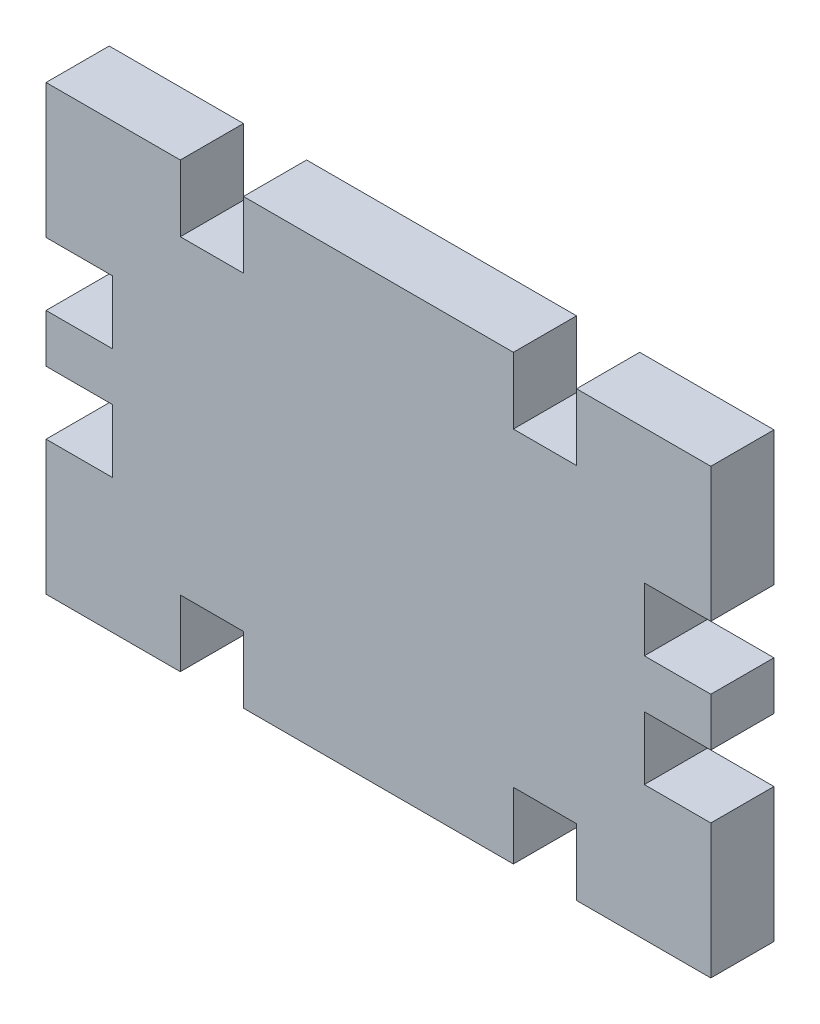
SolidWorks part; units mm, degrees
ref_plane "Piano frontale" through (0, 0, 0) normal (0, 0, 1) x (1, 0, 0)
ref_plane "Piano superiore" through (0, 0, 0) normal (0, 1, 0) x (1, 0, 0)
ref_plane "Piano destro" through (0, 0, 0) normal (1, 0, 0) x (0, 0, -1)
sketch "Sketch3" plane through (0, 0, 0) normal (0, 0, 1) x (1, 0, 0)
  line L1 (21.6975, 12.7076) -> (81.6975, 12.7076)
  line L2 (21.6975, 12.7076) -> (21.6975, -27.2924)
  line L3 (21.6975, -27.2924) -> (81.6975, -27.2924)
  line L4 (81.6975, 12.7076) -> (81.6975, -27.2924)
  dimension "D1" = 40
  dimension "D2" = 60
extrude "Boss-Extrude1" add sketch "Sketch3" along normal blind 5.7
sketch "Sketch9" plane through (0, 0, 5.7) normal (0, 0, 1) x (1, 0, 0)
  line L0 (21.6975, 12.7076) -> (21.6975, -27.2924) construction
  line L1 (33.6975, -15.2924) -> (21.6975, -27.2924) construction
  line L2 (21.6975, -9.4741) -> (27.6975, -9.4741)
  line L3 (33.8159, -27.2924) -> (39.5159, -27.2924)
  line L4 (33.8159, -27.2924) -> (33.8159, -21.2924)
  line L5 (33.8159, -21.2924) -> (39.5159, -21.2924)
  line L6 (21.6975, -27.2924) -> (81.6975, -27.2924) construction
  line L7 (39.5159, -27.2924) -> (39.5159, -21.2924)
  line L8 (21.6975, -15.1741) -> (21.6975, -9.4741)
  line L9 (21.6975, -15.1741) -> (27.6975, -15.1741)
  line L10 (27.6975, -15.1741) -> (27.6975, -9.4741)
  line L11 (39.5159, 12.7076) -> (39.5159, 6.7076)
  line L12 (21.6975, -7.2924) -> (81.6975, -7.2924) construction
  line L13 (81.6975, -27.2924) -> (81.6975, 12.7076) construction
  line L14 (51.6975, 12.7076) -> (51.6975, -27.3575) construction
  line L15 (81.6975, 12.7076) -> (21.6975, 12.7076) construction
  line L16 (33.8159, 6.7076) -> (39.5159, 6.7076)
  line L17 (33.8159, 12.7076) -> (33.8159, 6.7076)
  line L18 (33.8159, 12.7076) -> (39.5159, 12.7076)
  line L19 (27.6975, 0.5892) -> (27.6975, -5.1108)
  line L20 (21.6975, 0.5892) -> (27.6975, 0.5892)
  line L21 (21.6975, 0.5892) -> (21.6975, -5.1108)
  line L22 (21.6975, -5.1108) -> (27.6975, -5.1108)
  line L23 (81.6975, -5.1108) -> (75.6975, -5.1108)
  line L24 (81.6975, 0.5892) -> (81.6975, -5.1108)
  line L25 (81.6975, 0.5892) -> (75.6975, 0.5892)
  line L26 (75.6975, 0.5892) -> (75.6975, -5.1108)
  line L27 (69.5792, 12.7076) -> (63.8792, 12.7076)
  line L28 (69.5792, 12.7076) -> (69.5792, 6.7076)
  line L29 (69.5792, 6.7076) -> (63.8792, 6.7076)
  line L30 (63.8792, 12.7076) -> (63.8792, 6.7076)
  line L31 (63.8792, -27.2924) -> (63.8792, -21.2924)
  line L32 (69.5792, -21.2924) -> (63.8792, -21.2924)
  line L33 (69.5792, -27.2924) -> (69.5792, -21.2924)
  line L34 (69.5792, -27.2924) -> (63.8792, -27.2924)
  line L35 (75.6975, -15.1741) -> (75.6975, -9.4741)
  line L36 (81.6975, -15.1741) -> (75.6975, -15.1741)
  line L37 (81.6975, -15.1741) -> (81.6975, -9.4741)
  line L38 (81.6975, -9.4741) -> (75.6975, -9.4741)
extrude "Cut-Extrude9" cut sketch "Sketch9" against normal blind 10
equation "\"r\"= 12mm"
equation "\"h\"= 5.7mm"
equation "\"l\"= 60mm"
equation "\"lh\"= 40mm"
equation "\"D1\" = \"r\" / 3"
equation "\"D2\"= \"h\""
equation "\"D3\" = \"r\" / 3"
equation "\"D2@Sketch9\"=\"h\""
equation "\"D3@Sketch9\"=\"r\"/2"
equation "\"D1@Boss-Extrude1\"=\"h\""
equation "\"D4@Sketch9\"=\"r\""
equation "\"D1@Sketch9\"=\"r\""
